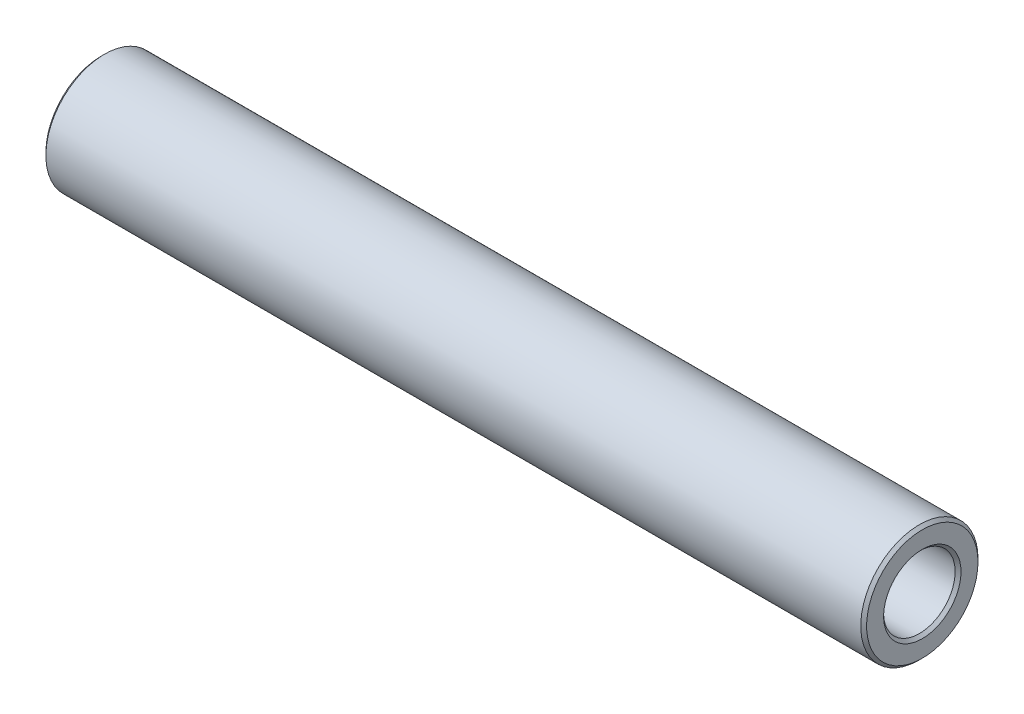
SolidWorks part; units mm, degrees
ref_plane "Спереди" through (0, 0, 0) normal (0, 0, 1) x (1, 0, 0)
ref_plane "Сверху" through (0, 0, 0) normal (0, 1, 0) x (1, 0, 0)
ref_plane "Справа" through (0, 0, 0) normal (1, 0, 0) x (0, 0, -1)
sketch "Эскиз1" plane through (0, 0, 0) normal (1, 0, 0) x (0, 0, -1)
  circle A0 centre (0, 0) radius 3.05
  circle A1 centre (0, 0) radius 5
  dimension "D1" = 6.1
  dimension "D2" = 10
extrude "Бобышка-Вытянуть1" add sketch "Эскиз1" along normal blind 70
chamfer "Фаска1" distance 0.25 angle 45 4 edges at (0, 0, -3.05) (70, 0, -3.05) (0, 0, -5) (70, 0, -5)
